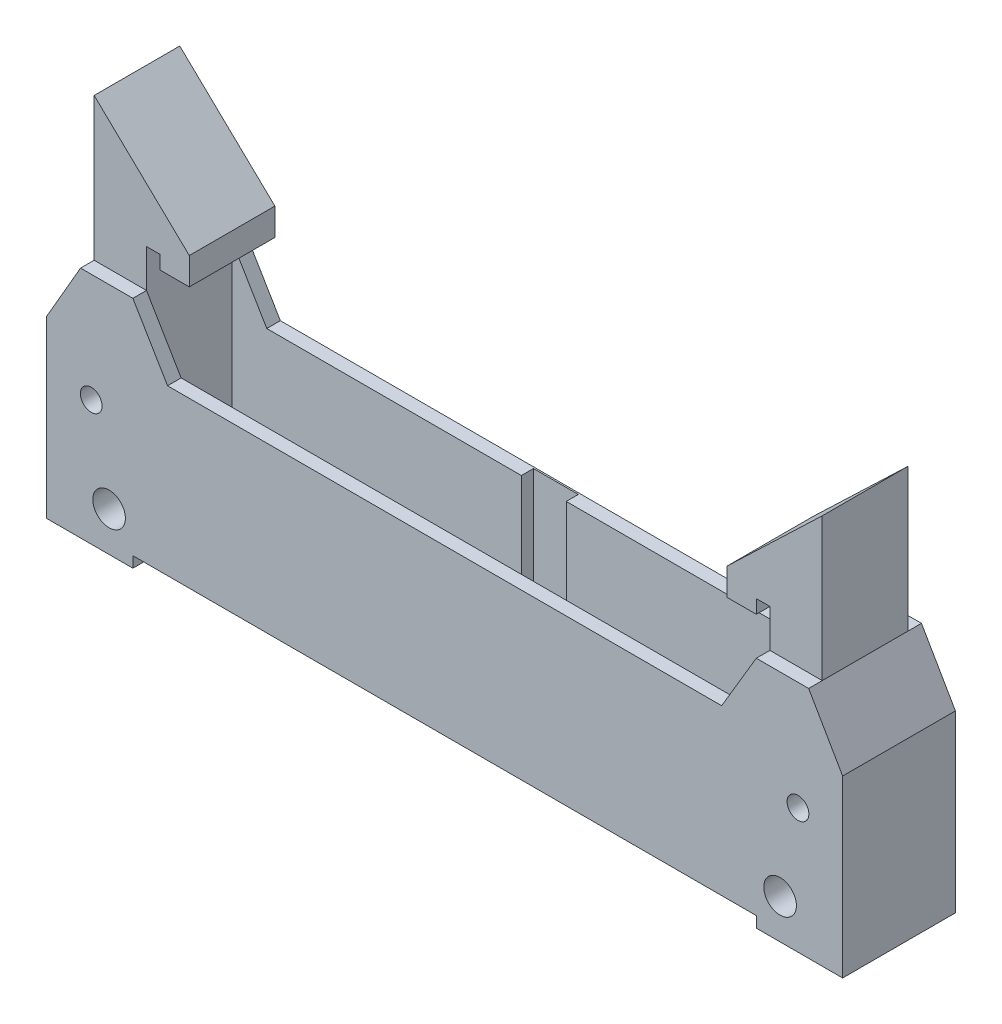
SolidWorks part; units mm, degrees
ref_plane "Front" through (0, 0, 0) normal (0, 0, 1) x (1, 0, 0)
ref_plane "Top" through (0, 0, 0) normal (0, 1, 0) x (1, 0, 0)
ref_plane "Right" through (0, 0, 0) normal (1, 0, 0) x (0, 0, -1)
sketch "Sketch1" plane through (0, 0, 0) normal (0, 0, 1) x (1, 0, 0)
  line L0 (-29.285, 12.8699) -> (-26.785, 17.2)
  line L1 (-29.285, 0) -> (-22.935, 0)
  line L2 (-29.285, 0) -> (-29.285, 12.8699)
  line L3 (-26.785, 17.2) -> (-26.785, 27.7)
  line L4 (29.285, 0) -> (29.285, 12.8699)
  line L5 (-19.785, 19) -> (-19.785, 21)
  line L6 (0, 0) -> (0, 32.6307) construction
  line L7 (-19.785, 19) -> (-21.935, 19)
  line L8 (-21.935, 19) -> (-21.935, 20)
  line L9 (-21.935, 20) -> (-22.935, 20)
  line L10 (-22.935, 20) -> (-22.935, 17.2)
  line L11 (-22.935, 17.2) -> (-20.3835, 12.9)
  line L12 (-20.3835, 12.9) -> (0, 12.9)
  line L13 (20.3835, 12.9) -> (0, 12.9)
  line L14 (22.935, 17.2) -> (20.3835, 12.9)
  line L15 (22.935, 20) -> (22.935, 17.2)
  line L16 (21.935, 20) -> (22.935, 20)
  line L17 (21.935, 19) -> (21.935, 20)
  line L18 (19.785, 19) -> (21.935, 19)
  line L19 (19.785, 21) -> (26.785, 27.7)
  line L20 (26.785, 17.2) -> (26.785, 27.7)
  line L21 (29.285, 12.8699) -> (26.785, 17.2)
  line L22 (22.935, 0) -> (29.285, 0)
  line L23 (-22.935, 0.8) -> (22.935, 0.8)
  line L24 (-22.935, 0.8) -> (-22.935, 0)
  line L25 (-19.785, 21) -> (-26.785, 27.7)
  line L26 (22.935, 0.8) -> (22.935, 0)
  line L27 (19.785, 19) -> (19.785, 21)
  point P26 (0, 0.8)
  dimension "D1" = 58.57
  dimension "D2" = 12.9
  dimension "D3" = 27.7
  dimension "D4" = 17.2
  dimension "D5" = 45.87
  dimension "D6" = 0.8
  dimension "D7" = 30
  dimension "D8" = 2.5
  dimension "D9" = 7
  dimension "D10" = 19
  dimension "D11" = 20
  dimension "D12" = 21
  dimension "D13" = 1
extrude "Extrude1" add sketch "Sketch1" along normal mid plane 8.3
sketch "Sketch2" plane through (0, 12.9, 0) normal (0, 1, 0) x (-1, 0, 0)
  line L0 (22.935, 4.15) -> (22.935, -4.15) construction
  line L1 (22.935, -3.15) -> (-22.935, -3.15)
  line L2 (22.935, -3.15) -> (22.935, 3.15)
  line L3 (22.935, 3.15) -> (-22.935, 3.15)
  line L4 (-22.935, -3.15) -> (-22.935, 3.15)
  line L5 (-22.935, 4.15) -> (-22.935, -4.15) construction
  line L6 (-20.3835, 4.15) -> (20.3835, 4.15) construction
  line L7 (-20.3835, -4.15) -> (20.3835, -4.15) construction
  dimension "D1" = 1
  dimension "D2" = 1
extrude "Cut-Extrude1" cut sketch "Sketch2" against normal offset from surface 1 and the other way up to vertex (6.1 mm away)
hole_wizard "Ø2.4 (2.4) Diameter Hole1" positions "Sketch4" profile "Sketch3" hole size "Ø2.4" standard "Ansi Metric"
sketch "Sketch4" plane through (0, 0, 4.15) normal (0, 0, 1) x (1, 0, 0)
  line L0 (22.935, 0) -> (29.285, 0) construction
  point P0 (-24.685, 2.905)
  point P1 (24.685, 2.905)
  dimension "D1" = 2.905
  dimension "D2" = 49.37
  dimension "D3" = 24.685
sketch "Sketch3" plane through (-24.685, 2.905, 4.15) normal (1, 0, 0) x (0, -1, 0)
  line L0 (0, 0) -> (0, 8.3)
  line L1 (0, 8.3) -> (1.2, 8.3)
  line L2 (1.2, 8.3) -> (1.2, 0)
  line L5 (1.2, 0) -> (0, 0)
  line L11 (0, -6.35) -> (0, 107.95) construction
  dimension "Thru Hole Dia." = 2.4
  dimension "Thru Hole Depth" = 8.3
sketch "Sketch5" plane through (0, 0, 4.15) normal (0, 0, 1) x (1, 0, 0)
  line L0 (-29.285, 12.8699) -> (-29.285, 0) construction
  line L1 (-29.285, 0) -> (-22.935, 0) construction
  line L2 (29.285, 0) -> (29.285, 12.8699) construction
  circle A0 centre (-19.685, -2.7) radius 0.25
  circle A1 centre (-18.415, -0.795) radius 0.25
  circle A2 centre (-18.415, 3.015) radius 0.25
  circle A3 centre (-19.685, 1.11) radius 0.25
  circle A4 centre (-17.145, -2.7) radius 0.25
  circle A5 centre (-15.875, -0.795) radius 0.25
  circle A6 centre (-17.145, 1.11) radius 0.25
  circle A7 centre (-15.875, 3.015) radius 0.25
  circle A8 centre (-14.605, -2.7) radius 0.25
  circle A9 centre (-13.335, -0.795) radius 0.25
  circle A10 centre (-14.605, 1.11) radius 0.25
  circle A11 centre (-13.335, 3.015) radius 0.25
  circle A12 centre (-12.065, -2.7) radius 0.25
  circle A13 centre (-10.795, -0.795) radius 0.25
  circle A14 centre (-12.065, 1.11) radius 0.25
  circle A15 centre (-10.795, 3.015) radius 0.25
  circle A16 centre (-9.525, -2.7) radius 0.25
  circle A17 centre (-8.255, -0.795) radius 0.25
  circle A18 centre (-9.525, 1.11) radius 0.25
  circle A19 centre (-8.255, 3.015) radius 0.25
  circle A20 centre (-6.985, -2.7) radius 0.25
  circle A21 centre (-5.715, -0.795) radius 0.25
  circle A22 centre (-6.985, 1.11) radius 0.25
  circle A23 centre (-5.715, 3.015) radius 0.25
  circle A24 centre (-4.445, -2.7) radius 0.25
  circle A25 centre (-3.175, -0.795) radius 0.25
  circle A26 centre (-4.445, 1.11) radius 0.25
  circle A27 centre (-3.175, 3.015) radius 0.25
  circle A28 centre (-1.905, -2.7) radius 0.25
  circle A29 centre (-0.635, -0.795) radius 0.25
  circle A30 centre (-1.905, 1.11) radius 0.25
  circle A31 centre (-0.635, 3.015) radius 0.25
  circle A32 centre (0.635, -2.7) radius 0.25
  circle A33 centre (1.905, -0.795) radius 0.25
  circle A34 centre (0.635, 1.11) radius 0.25
  circle A35 centre (1.905, 3.015) radius 0.25
  circle A36 centre (3.175, -2.7) radius 0.25
  circle A37 centre (4.445, -0.795) radius 0.25
  circle A38 centre (3.175, 1.11) radius 0.25
  circle A39 centre (4.445, 3.015) radius 0.25
  circle A40 centre (5.715, -2.7) radius 0.25
  circle A41 centre (6.985, -0.795) radius 0.25
  circle A42 centre (5.715, 1.11) radius 0.25
  circle A43 centre (6.985, 3.015) radius 0.25
  circle A44 centre (8.255, -2.7) radius 0.25
  circle A45 centre (9.525, -0.795) radius 0.25
  circle A46 centre (8.255, 1.11) radius 0.25
  circle A47 centre (9.525, 3.015) radius 0.25
  circle A48 centre (10.795, -2.7) radius 0.25
  circle A49 centre (12.065, -0.795) radius 0.25
  circle A50 centre (10.795, 1.11) radius 0.25
  circle A51 centre (12.065, 3.015) radius 0.25
  circle A52 centre (13.335, -2.7) radius 0.25
  circle A53 centre (14.605, -0.795) radius 0.25
  circle A54 centre (13.335, 1.11) radius 0.25
  circle A55 centre (14.605, 3.015) radius 0.25
  circle A56 centre (15.875, -2.7) radius 0.25
  circle A57 centre (17.145, -0.795) radius 0.25
  circle A58 centre (15.875, 1.11) radius 0.25
  circle A59 centre (17.145, 3.015) radius 0.25
  circle A60 centre (18.415, -2.7) radius 0.25
  circle A61 centre (19.685, -0.795) radius 0.25
  circle A62 centre (18.415, 1.11) radius 0.25
  circle A63 centre (19.685, 3.015) radius 0.25
  dimension "D1" = 0.5
  dimension "D6" = 9.6
  dimension "D8" = 9.6
  dimension "D9" = 39.37
  dimension "D7" = 2.54
  dimension "D2" = 3.81
  dimension "D3" = 3.81
  dimension "D4" = 1.27
  dimension "D5" = 1.905
  dimension "D10" = 2.7
sketch "Sketch6" plane through (0, 12.9, 0) normal (0, 1, 0) x (-1, 0, 0)
  line L0 (0, -4.15) -> (0, -2.896) construction
  line L5 (-20.3835, -4.15) -> (20.3835, -4.15) construction
  line L7 (22.935, -3.15) -> (-22.935, -3.15) construction
  line L8 (-1.651, -2.896) -> (1.651, -2.896)
  line L9 (-1.651, -2.896) -> (-1.651, -4.039)
  line L10 (-1.651, -4.039) -> (1.651, -4.039)
  line L11 (1.651, -2.896) -> (1.651, -4.039)
  dimension "D4" = 0.889
  dimension "D5" = 1.143
  dimension "D6" = 1.651
extrude "Cut-Extrude2" cut sketch "Sketch6" against normal up to vertex (11.1 mm away)
ref_plane "Plane1" through (0, 27.7, 0) normal (0, 1, 0) x (-1, 0, 0)
ref_plane "Plane2" through (0, 0, 3.15) normal (0, 0, 1) x (1, 0, 0)
sketch "Sketch7" plane through (0, 27.7, 0) normal (0, 1, 0) x (-1, 0, 0)
  line L0 (22.935, 4.15) -> (22.935, 3.15) construction
  line L1 (22.935, 4.15) -> (22.935, 3.15) construction
  line L2 (22.935, -3.15) -> (22.935, -4.15) construction
  line L3 (22.935, -3.15) -> (22.935, -4.15) construction
  line L4 (-22.935, 4.15) -> (-22.935, 3.15) construction
  line L5 (-22.935, 4.15) -> (-22.935, 3.15) construction
  line L6 (-22.935, -3.15) -> (-22.935, -4.15) construction
  line L7 (-22.935, -3.15) -> (-22.935, -4.15) construction
  line L9 (30.3113, -4.15) -> (-30.9477, -4.15)
  line L10 (30.3113, -4.15) -> (30.3113, -3.15)
  line L11 (30.3113, -3.15) -> (-30.9477, -3.15)
  line L12 (-30.9477, -4.15) -> (-30.9477, -3.15)
  line L13 (31.3721, 3.15) -> (-30.9477, 3.15)
  line L14 (31.3721, 3.15) -> (31.3721, 4.15)
  line L15 (31.3721, 4.15) -> (-30.9477, 4.15)
  line L16 (-30.9477, 3.15) -> (-30.9477, 4.15)
extrude "Cut-Extrude3" cut sketch "Sketch7" against normal up to vertex (10.5 mm away)
sketch "Sketch8" plane through (0, 0, 4.15) normal (0, 0, 1) x (1, 0, 0)
  line L0 (26.785, 17.2) -> (22.935, 17.2) construction
  circle A0 centre (26, 9.2) radius 0.8
  circle A1 centre (-26, 9.2) radius 0.8
  dimension "D4" = 1.6
  dimension "D1" = 8
  dimension "D2" = 52
  dimension "D3" = 26
extrude "Cut-Extrude4" cut sketch "Sketch8" against normal through all
sketch "Sketch10" plane through (0, 0, 3.15) normal (0, 0, 1) x (1, 0, 0)
  line L1 (0, 0) -> (0, 23.205) construction
  line L4 (22.935, 17.2) -> (17.9914, 17.2)
  line L5 (22.935, 1.8) -> (29.285, 1.8)
  line L9 (31.1771, 17.2) -> (26.785, 17.2)
  line L10 (31.1771, 17.2) -> (31.1771, 28.3968)
  line L11 (31.1771, 28.3968) -> (17.9914, 28.3968)
  line L12 (22.935, 1.8) -> (22.935, 17.2) construction
  line L14 (22.935, 1.8) -> (22.935, 17.2)
  line L15 (17.9914, 17.2) -> (17.9914, 28.3968)
  line L16 (29.285, 0) -> (29.285, 12.8699) construction
  line L17 (29.285, 12.8699) -> (26.785, 17.2) construction
  line L19 (29.285, 1.8) -> (29.285, 12.8699)
  line L20 (29.285, 12.8699) -> (26.785, 17.2)
  line L21 (-29.285, 12.8699) -> (-26.785, 17.2)
  line L22 (-29.285, 1.8) -> (-29.285, 12.8699)
  line L23 (-17.9914, 17.2) -> (-17.9914, 28.3968)
  line L24 (-22.935, 1.8) -> (-22.935, 17.2)
  line L25 (-31.1771, 28.3968) -> (-17.9914, 28.3968)
  line L26 (-31.1771, 17.2) -> (-31.1771, 28.3968)
  line L27 (-31.1771, 17.2) -> (-26.785, 17.2)
  line L28 (-22.935, 1.8) -> (-29.285, 1.8)
  line L29 (-22.935, 17.2) -> (-17.9914, 17.2)
extrude "Cut-Extrude5" [suppressed] cut sketch "Sketch10" against normal up to vertex
sketch "Sketch9" plane through (0, 0, 3.15) normal (0, 0, 1) x (1, 0, 0)
  line L0 (0, 0) -> (0, 32.8392) construction
  line L1 (26, 9.2) -> (26, 29.4793) construction
  line L2 (37, 0) -> (37, 32.8392) construction
  line L3 (37, 24.1244) -> (26, 9.2) construction
  line L8 (-28.6832, 11.7725) -> (-37.0098, 24.1172)
  line L9 (-28.6832, 10.0292) -> (-23.2508, 1.9752)
  line L10 (-28.6832, 11.7725) -> (-28.6832, 10.0292)
  line L11 (-19.2508, 4.6732) -> (-23.2508, 1.9752)
  line L12 (-29.5123, 19.8865) -> (-19.2508, 4.6732)
  line L13 (-28.6832, 20.4457) -> (-29.5123, 19.8865)
  line L14 (-28.124, 19.6166) -> (-28.6832, 20.4457)
  line L15 (-26.3416, 20.8189) -> (-28.124, 19.6166)
  line L16 (-27.46, 22.477) -> (-26.3416, 20.8189)
  line L19 (37.0098, 24.1172) -> (27.46, 22.477)
  line L20 (27.46, 22.477) -> (26.3416, 20.8189)
  line L21 (26.3416, 20.8189) -> (28.124, 19.6166)
  line L22 (28.124, 19.6166) -> (28.6832, 20.4457)
  line L23 (28.6832, 20.4457) -> (29.5123, 19.8865)
  line L24 (29.5123, 19.8865) -> (19.2508, 4.6732)
  line L26 (28.6832, 11.7725) -> (37.0098, 24.1172)
  line L28 (19.2508, 4.6732) -> (23.2508, 1.9752)
  line L29 (28.6832, 11.7725) -> (28.6832, 10.0292)
  line L30 (28.6832, 10.0292) -> (23.2508, 1.9752)
  line L31 (-37.0098, 24.1172) -> (-27.46, 22.477)
  circle A0 centre (26, 9.2) radius 18.5402 construction
  dimension "D3" = 37.0804
  dimension "D2" = 36.392
  dimension "D1" = 37
extrude "Extrude2" [suppressed] add sketch "Sketch9" against normal up to vertex
equation "\"D2@Sketch2\" = \"D1@Sketch2\""
equation "\"D3@Sketch4\" = \"D2@Sketch4\"/2"
equation "\"D3@Sketch5\" = \"D2@Sketch5\""
equation "\"D4@Sketch5\" = \"D7@Sketch5\"/2"
equation "\"D3@Sketch8\" = \"D2@Sketch8\"/2"
